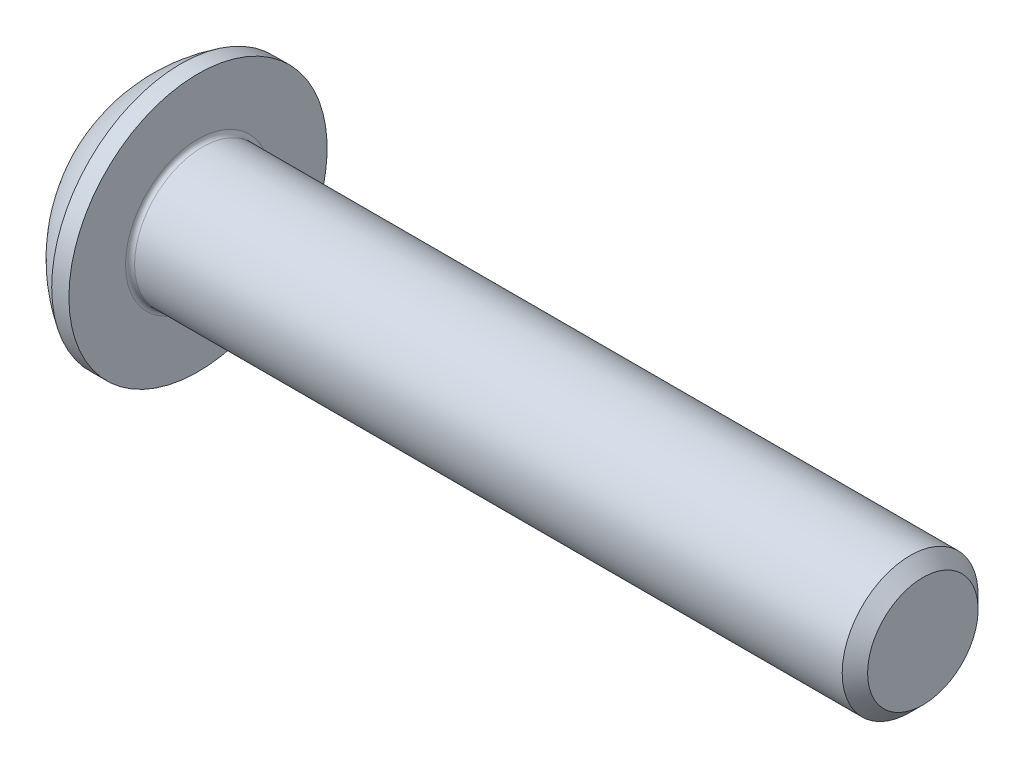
SolidWorks part; units mm, degrees
ref_plane "Plane1" through (0, 0, 0) normal (0, 0, 1) x (1, 0, 0)
ref_plane "Plane2" through (0, 0, 0) normal (0, 1, 0) x (1, 0, 0)
ref_plane "Plane3" through (0, 0, 0) normal (1, 0, 0) x (0, 0, -1)
other "Configuration Table"
sketch "BodySke" plane through (0, 0, 0) normal (0, 0, 1) x (1, 0, 0)
  line L0 (17.65, 0) -> (17.65, 1.2195)
  line L1 (17.3695, 1.5) -> (1.65, 1.5)
  line L2 (1.65, 1.5) -> (1.65, 2.85)
  line L3 (1.65, 2.85) -> (1.27, 2.85)
  line L4 (0, 0) -> (101.6, 0) construction
  line L5 (1.65, -2.85) -> (1.27, -2.85) construction
  line L6 (55.6768, -1.5) -> (1.65, -1.5) construction
  line L7 (17.65, 0) -> (0, 0)
  line L8 (0, 1.425) -> (0, -1.425) construction
  line L9 (0, 0) -> (0, 1.425)
  line L10 (17.65, 1.2195) -> (17.3695, 1.5)
  line L11 (17.65, -1.2195) -> (17.3695, -1.5) construction
  line L12 (2.15, 9.525) -> (2.15, -1.5) construction
  line L13 (5.65, 9.525) -> (5.65, -1.5) construction
  arc A1 (0, 1.425) -> (1.27, 2.85) centre (3.0334, 0) cw
revolve "BaseBody" add sketch "BodySke" angle 360 about L4
fillet "Fillet1" radius 0.1 1 edges at (1.65, 0, 1.5)
sketch "Sketch2" plane through (0, 0, 0) normal (0, 0, 1) x (1, 0, 0)
  line L0 (0, 1) -> (1.04, 1)
  line L1 (1.04, 1) -> (1.6174, 0)
  line L3 (1.6174, 0) -> (0, 0)
  line L4 (0, 0) -> (0, 1)
  line L5 (0, -1) -> (1.04, -1) construction
  line L6 (0, 0) -> (47.625, 0) construction
  dimension "D2" = 60
  dimension "PreBroach_depth" = 1.04
  dimension "PreBroach_dia" = 2
revolve "PreBroach" cut sketch "Sketch2" angle 360 about L6
sketch "Sketch3" plane through (0, 0, 0) normal (1, 0, 0) x (0, 0, -1)
  line L0 (-1, -0.5774) -> (-1, 0.5774)
  line L1 (-1, 0.5774) -> (0, 1.1547)
  line L2 (0, 1.1547) -> (1, 0.5774)
  line L3 (1, 0.5774) -> (1, -0.5774)
  line L4 (1, -0.5774) -> (0, -1.1547)
  line L5 (0, -1.1547) -> (-1, -0.5774)
extrude "Hex" cut sketch "Sketch3" along normal blind 1.04
sketch "ThdSchSke" plane through (0, 0, 0) normal (0, 0, 1) x (1, 0, 0)
  line L0 (5.65, -1.2195) -> (5.4536, -1.5)
  line L1 (5.65, -1.2195) -> (5.8464, -1.5)
  line L2 (5.8464, -1.5) -> (5.8464, -1.875)
  line L3 (-3.175, 0) -> (5.1513, 0) construction
  line L5 (5.8464, -1.875) -> (5.4536, -1.875)
  line L6 (5.4536, -1.875) -> (5.4536, -1.5)
revolve "ThreadSchematic" [suppressed] cut sketch "ThdSchSke" angle 360 about L3
pattern_linear "ThdSchPat" [suppressed]
equation "\"D1@BodySke\" = \"Head_dia@BodySke\" * .5"
equation "\"Thread_minor@ThreadCosmetic\" = \"Minor_dia@BodySke\""
equation "\"D1@Sketch3\" = \"Hex_size@Sketch3\" / 2"
equation "\"D2@Sketch3\" = \"D1@Sketch3\""
equation "\"D3@Sketch3\" = \"Hex_size@Sketch3\""
equation "\"Thread_length@ThreadCosmetic\" = ((sgn( (\"Length@BodySke\" - \"Advance@BodySke\" * 2.0) - \"Thread_nom@BodySke\" )-1)*( (\"Length@BodySke\" - \"Advance@BodySke\" * 2.0) - \"Thread_nom@BodySke\" ))/-2+ \"Thread_no"
equation "\"Thread_minor@ThdSchSke\" = \"Minor_dia@BodySke\""
equation "\"Diameter@ThdSchSke\" = \"Diameter@BodySke\""
equation "\"Overcut@ThdSchSke\" = \"Diameter@BodySke\" * 1.25"
equation "\"Start@ThdSchSke\" = \"Head_ht@BodySke\" + \"Length@BodySke\" - \"Thread_length@ThreadCosmetic\"  '---Non-countersunk---"
equation "\"Num_threads@ThdSchPat\" = int( \"Thread_length@ThreadCosmetic\" / \"Advance@BodySke\" + 0.999 )  + 1"
equation "\"Advance@ThdSchPat\" = \"Thread_length@ThreadCosmetic\" /  (\"Num_threads@ThdSchPat\" - 1) 'relax it"
equation "\"Num_threads@ThdSchPat\" = \"Num_threads@ThdSchPat\" - sgn( \"Num_threads@ThdSchPat\" - 1) '---chamfered tips only---"
